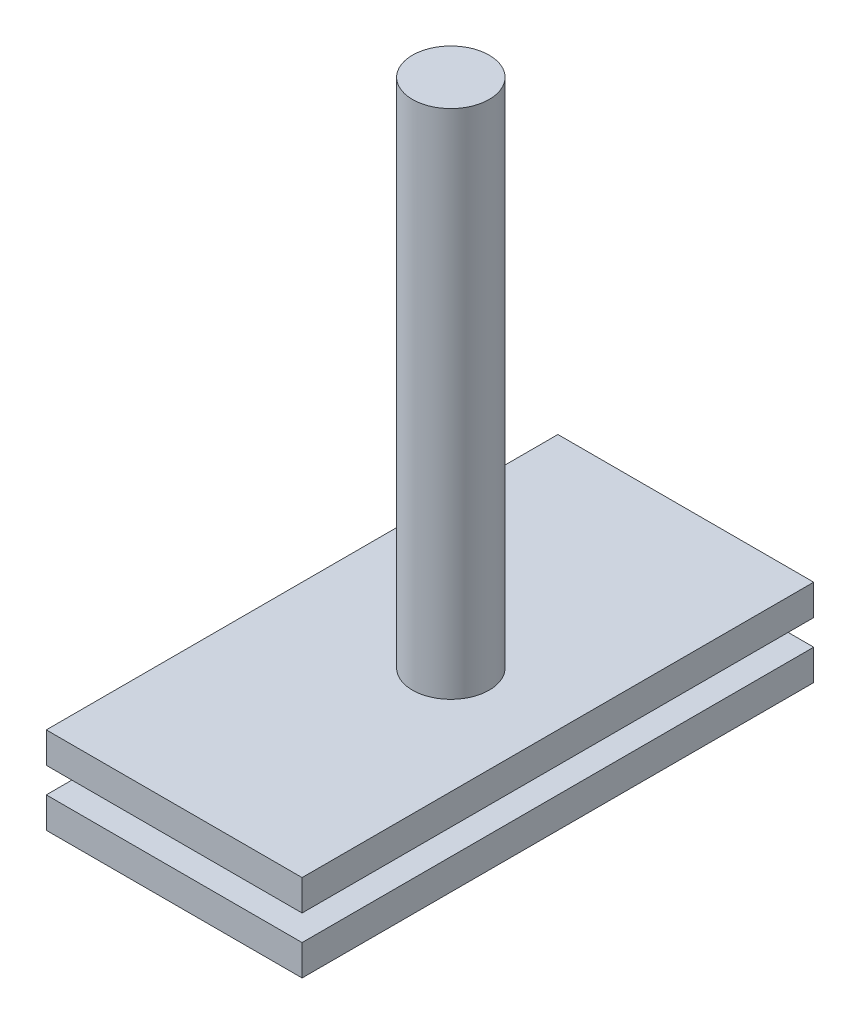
SolidWorks part; units mm, degrees
ref_plane "前视基准面" through (0, 0, 0) normal (0, 0, 1) x (1, 0, 0)
ref_plane "上视基准面" through (0, 0, 0) normal (0, 1, 0) x (1, 0, 0)
ref_plane "右视基准面" through (0, 0, 0) normal (1, 0, 0) x (0, 0, -1)
sketch "草图1" plane through (0, 0, 0) normal (0, 0, 1) x (1, 0, 0)
  line L1 (0, 0) -> (-10, 0)
  line L2 (0, 0) -> (0, -1.2)
  line L3 (0, -1.2) -> (-10, -1.2)
  line L4 (-10, 0) -> (-10, -1.2)
  line L5 (-10, 2.2) -> (0, 2.2)
  line L6 (-10, 2.2) -> (-10, 1)
  line L7 (-10, 1) -> (0, 1)
  line L8 (0, 2.2) -> (0, 1)
  dimension "D1" = 10
  dimension "D2" = 1.2
  dimension "D3" = 1.2
  dimension "D4" = 1
extrude "凸台-拉伸1" add sketch "草图1" along normal blind 20
sketch "草图2" plane through (0, 2.2, 0) normal (0, 1, 0) x (1, 0, 0)
  line L0 (-4.1857, 0) -> (-4.1857, -20) construction
  line L1 (0, 0) -> (-10, 0) construction
  line L2 (0, -20) -> (-10, -20) construction
  circle A0 centre (-4.1857, -10) radius 1.5
  dimension "D1" = 3
extrude "凸台-拉伸2" add sketch "草图2" along normal blind 20
